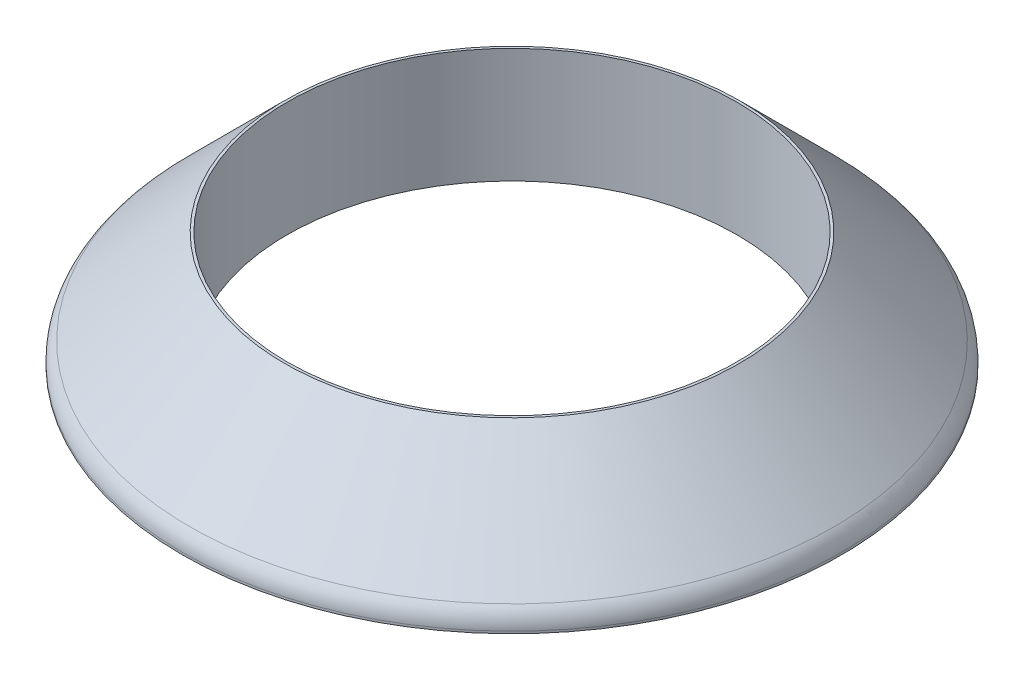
SolidWorks part; units mm, degrees
ref_plane "Front Plane" through (0, 0, 0) normal (0, 0, 1) x (1, 0, 0)
ref_plane "Top Plane" through (0, 0, 0) normal (0, 1, 0) x (1, 0, 0)
ref_plane "Right Plane" through (0, 0, 0) normal (1, 0, 0) x (0, 0, -1)
sketch "Sketch1" plane through (0, 0, 0) normal (0, 0, 1) x (1, 0, 0)
  line L0 (-110.49, 0) -> (-161.8387, 0)
  line L1 (-161.8387, 0) -> (-161.8387, 1.0895)
  line L2 (-158.119, 10.0697) -> (-111.76, 56.4287)
  line L3 (-110.49, 56.4287) -> (-110.49, 0)
  line L4 (-114.3, 48.5006) -> (-114.3, 6.985)
  line L5 (-114.3, 48.5006) -> (-153.5705, 9.2301)
  line L6 (-151.3255, 3.81) -> (-117.475, 3.81)
  line L7 (-111.76, 56.4287) -> (-110.49, 56.4287)
  line L8 (0, 0) -> (0, 73.3236) construction
  line L9 (-161.8387, -152.4) -> (-161.8387, 0) construction
  arc A0 (-117.475, 3.81) -> (-114.3, 6.985) centre (-117.475, 6.985) ccw
  arc A1 (-153.5705, 9.2301) -> (-151.3255, 3.81) centre (-151.3255, 6.985) ccw
  arc A2 (-161.8387, 1.0895) -> (-158.119, 10.0697) centre (-149.1387, 1.0895) cw
  point P14 (-161.8387, 6.35)
  dimension "D5" = 3.175
  dimension "D6" = 12.7
  dimension "D1" = 3.81
  dimension "D2" = 3.81
  dimension "D3" = 3.81
  dimension "D4" = 6.35
  dimension "D7" = 1.27
  dimension "D8" = 220.98
  dimension "D9" = 45
revolve "Revolve1" add sketch "Sketch1" angle 360 about L8
